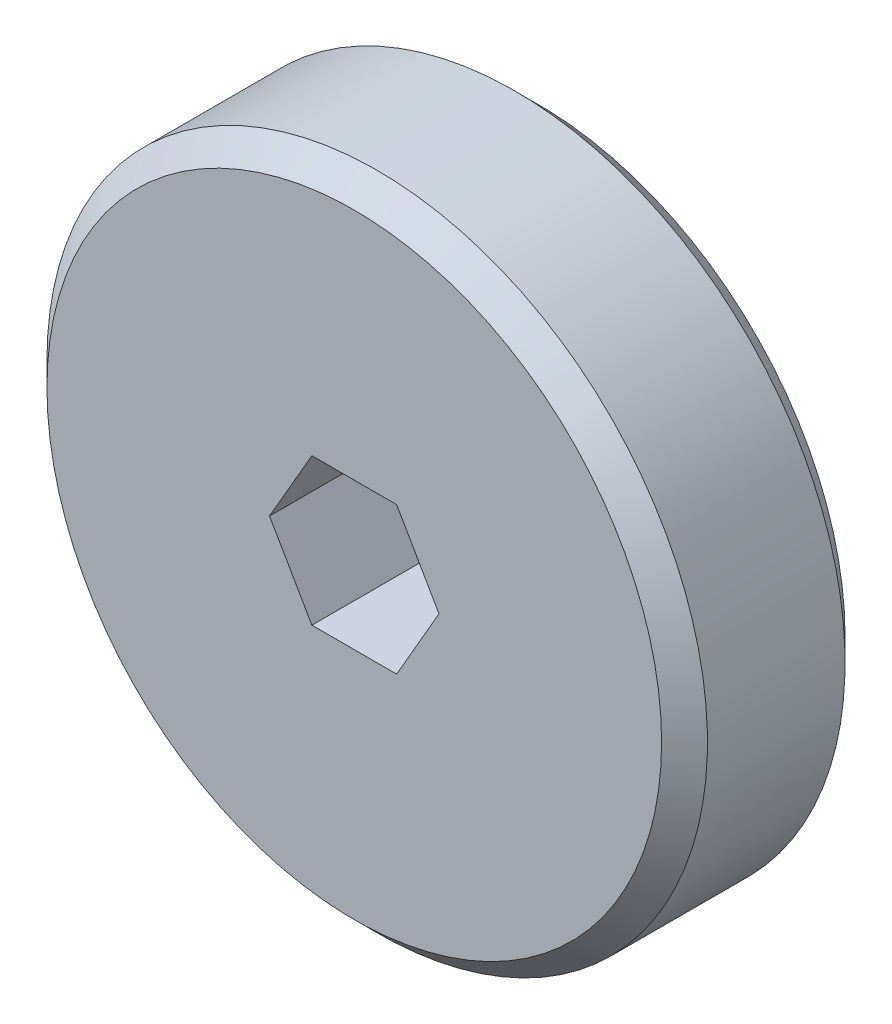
SolidWorks part; units mm, degrees
ref_plane "Front" through (0, 0, 0) normal (0, 0, 1) x (1, 0, 0)
ref_plane "Top" through (0, 0, 0) normal (0, 1, 0) x (1, 0, 0)
ref_plane "Right" through (0, 0, 0) normal (1, 0, 0) x (0, 0, -1)
sketch "Logo3_Revol_Axis" plane through (0, 0, 0) normal (0, 1, 0) x (1, 0, 0)
  line L0 (0, -43.5172) -> (0, 43.5172) construction
sketch "Logo3_bib1" plane through (0, 0, 0) normal (0, -1, 0) x (-1, 0, 0)
  line L0 (0, -7.9375) -> (0, 0)
  line L1 (0, 0) -> (13.2956, 0)
  line L5 (14.2875, -6.9456) -> (13.2956, -7.9375)
  line L6 (13.2956, -7.9375) -> (0, -7.9375)
  line L8 (13.2956, 0) -> (14.2875, -0.9919)
  line L9 (14.2875, -0.9919) -> (14.2875, -6.9456)
  line L10 (0, 10.5852) -> (0, -63.2873) construction
revolve "Revolve1" add sketch "Logo3_bib1" angle 360 about L10
sketch "Logo3_bib2" plane through (0, 0, 0) normal (0, 0, -1) x (1, 0, 0)
  line L1 (3.6662, 0) -> (1.8331, 3.175)
  line L2 (1.8331, 3.175) -> (-1.8331, 3.175)
  line L3 (-1.8331, 3.175) -> (-3.6662, 0)
  line L4 (-3.6662, 0) -> (-1.8331, -3.175)
  line L5 (-1.8331, -3.175) -> (1.8331, -3.175)
  line L6 (1.8331, -3.175) -> (3.6662, 0)
  circle A0 centre (0, 0) radius 3.175 construction
  dimension "Logo3_c1" = 6.35
extrude "Cut-Extrude1" cut sketch "Logo3_bib2" against normal through all
equation "\"D2@Cosmetic Thread1\" = \"Logo3_d1-pas@Logo3_bib1\""
